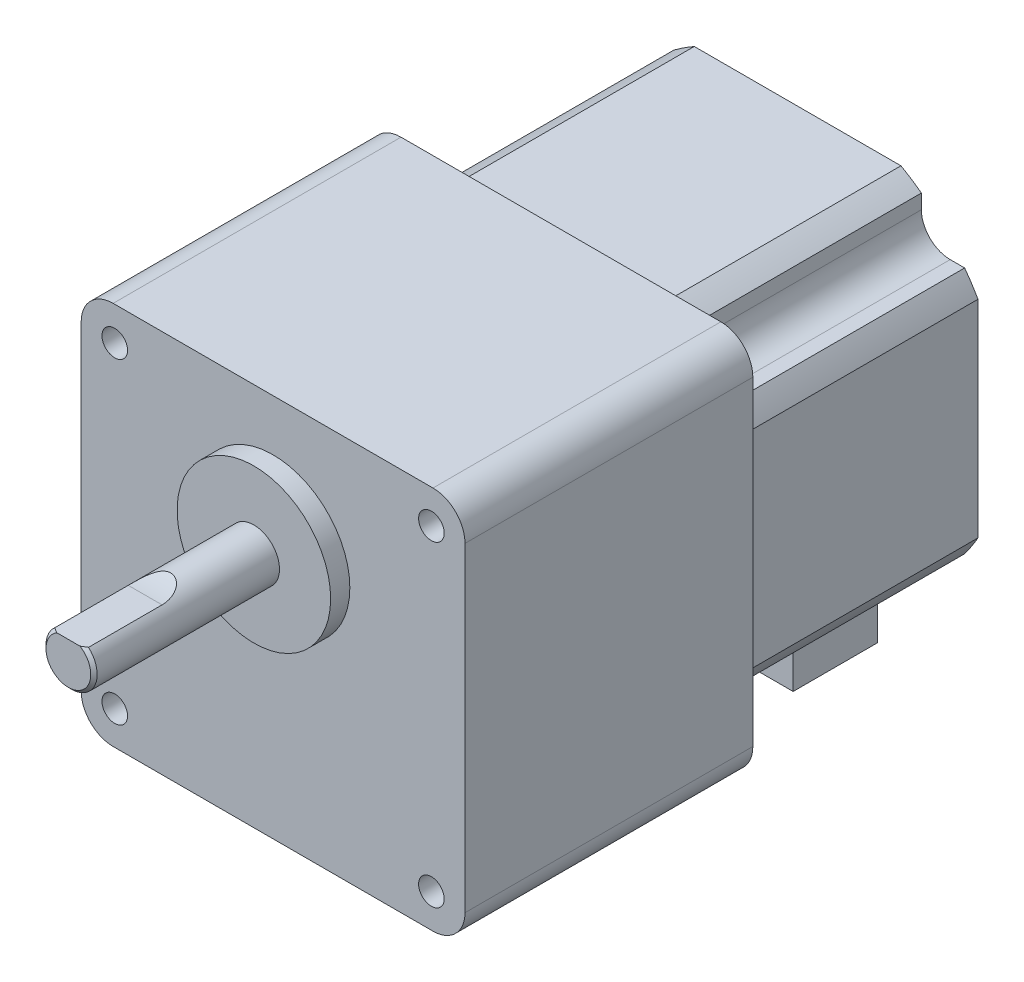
SolidWorks part; units mm, degrees
ref_plane "Front" through (0, 0, 0) normal (0, 0, 1) x (1, 0, 0)
ref_plane "Top" through (0, 0, 0) normal (0, 1, 0) x (1, 0, 0)
ref_plane "Right" through (0, 0, 0) normal (1, 0, 0) x (0, 0, -1)
sketch "Sketch1" plane through (0, 0, 0) normal (0, 0, 1) x (1, 0, 0)
  circle A0 centre (0, 0) radius 12
  dimension "D1" = 24
extrude "Extrude1" add sketch "Sketch1" along normal blind 3
sketch "Sketch2" plane through (0, 0, 3) normal (0, 0, 1) x (1, 0, 0)
  circle A0 centre (0, 0) radius 4
  dimension "D1" = 8
extrude "Extrude2" add sketch "Sketch2" along normal blind 29
chamfer "Chamfer1" distance 0.5 angle 45 1 edges at (4, 0, 32)
sketch "Sketch3" plane through (0, 0, 0) normal (1, 0, 0) x (0, 0, -1)
  line L0 (-32, 3) -> (-20, 3)
  line L1 (-32, 4) -> (-32, -4) construction
  line L2 (-20, 3) -> (-20, 11.5)
  line L3 (-20, 11.5) -> (-32, 11.5)
  line L4 (-32, 11.5) -> (-32, 3)
  line L5 (0, 0) -> (-32, 0) construction
  line L6 (-32, 4) -> (-7.262, 4) construction
  line L7 (-3, 4) -> (-31.5, 4) construction
  line L8 (-16, 4) -> (-16, 0) construction
  circle A0 centre (-20, 11.5) radius 8.5
  dimension "D1" = 3
  dimension "D2" = 12
  dimension "D3" = 16
extrude "Extrude3" cut sketch "Sketch3" against normal mid plane 10 contours A0 L3 L4 L0 | L3 A0 L2 | L2 A0 L3
sketch "Sketch4" plane through (0, 0, 0) normal (0, 0, -1) x (-1, 0, 0)
  line L0 (0, 0) -> (0, -10) construction
  line L1 (-25, -40) -> (25, -40)
  line L2 (-30, -35) -> (-30, 15)
  line L3 (-25, 20) -> (25, 20)
  line L4 (30, -35) -> (30, 15)
  line L5 (-30, -40) -> (30, 20) construction
  line L6 (-30, 20) -> (30, -40) construction
  arc A0 (30, -35) -> (25, -40) centre (25, -35) cw
  arc A1 (-25, -40) -> (-30, -35) centre (-25, -35) cw
  arc A2 (30, 15) -> (25, 20) centre (25, 15) ccw
  arc A3 (-25, 20) -> (-30, 15) centre (-25, 15) ccw
  point P0 (0, -10)
  dimension "D4" = 5
  dimension "D1" = 60
  dimension "D2" = 60
  dimension "D3" = 10
extrude "Extrude4" add sketch "Sketch4" along normal blind 45
sketch "Sketch6" plane through (0, 0, -45) normal (0, 0, -1) x (-1, 0, 0)
  line L0 (-32.5, -10) -> (32.5, -10) construction
  line L3 (0, 22.5) -> (0, -40.337) construction
  line L7 (28.2, -29.35) -> (-28.2, -29.35)
  line L8 (28.2, -29.35) -> (28.2, 9.35)
  line L9 (28.2, 9.35) -> (-28.2, 9.35)
  line L10 (-28.2, -29.35) -> (-28.2, 9.35)
  line L11 (28.2, -29.35) -> (-28.2, 9.35) construction
  line L12 (28.2, 9.35) -> (-28.2, -29.35) construction
  line L13 (-19.35, 18.2) -> (19.35, 18.2)
  line L14 (-19.35, 18.2) -> (-19.35, -38.2)
  line L15 (-19.35, -38.2) -> (19.35, -38.2)
  line L16 (19.35, 18.2) -> (19.35, -38.2)
  line L17 (-19.35, 18.2) -> (19.35, -38.2) construction
  line L18 (-19.35, -38.2) -> (19.35, 18.2) construction
  circle A0 centre (0, -10) radius 32.5
  dimension "D1" = 65
  dimension "D2" = 56.4
  dimension "D3" = 38.7
  dimension "D4" = 38.7
  dimension "D5" = 56.4
  dimension "D6" = 10
extrude "Extrude6" add sketch "Sketch6" along normal blind 37 contours L9 A0 L10 L7 L14 | L16 A0 L13 L14 L9 | L8 A0 L9 L16 L7 | L14 A0 L15 L16 L7 | L16 L9 L14 L7
fillet "Fillet1" radius 4.5 4 edges at (19.35, -29.35, -63.5) (-19.35, -29.35, -63.5) (-19.35, 9.35, -63.5) (19.35, 9.35, -63.5)
sketch "Sketch9" plane through (0, -38.2, 0) normal (0, -1, 0) x (1, 0, 0)
  line L1 (-12.5, -82) -> (12.5, -82)
  line L2 (-12.5, -82) -> (-12.5, -68.8)
  line L3 (-12.5, -68.8) -> (12.5, -68.8)
  line L4 (12.5, -82) -> (12.5, -68.8)
  line L5 (16.1558, -82) -> (-16.1558, -82) construction
  dimension "D1" = 25
  dimension "D2" = 13.2
  dimension "D3" = 12.5
extrude "Extrude9" add sketch "Sketch9" along normal blind 10 separate body
sketch "Sketch10" plane through (0, 0, 0) normal (0, 0, 1) x (1, 0, 0)
  line L1 (-24.7487, 14.7487) -> (24.7487, 14.7487) construction
  line L2 (-24.7487, 14.7487) -> (-24.7487, -34.7487) construction
  line L3 (-24.7487, -34.7487) -> (24.7487, -34.7487) construction
  line L4 (24.7487, 14.7487) -> (24.7487, -34.7487) construction
  line L5 (-24.7487, 14.7487) -> (24.7487, -34.7487) construction
  line L6 (-24.7487, -34.7487) -> (24.7487, 14.7487) construction
  circle A0 centre (0, -10) radius 35 construction
  circle A1 centre (24.7487, 14.7487) radius 2
  circle A2 centre (-24.7487, 14.7487) radius 2
  circle A3 centre (-24.7487, -34.7487) radius 2
  circle A4 centre (24.7487, -34.7487) radius 2
  point P0 (0, -10)
  dimension "D1" = 70
  dimension "D4" = 4
  dimension "D2" = 10
  dimension "D3" = 90
extrude "Extrude10" cut sketch "Sketch10" against normal blind 8
